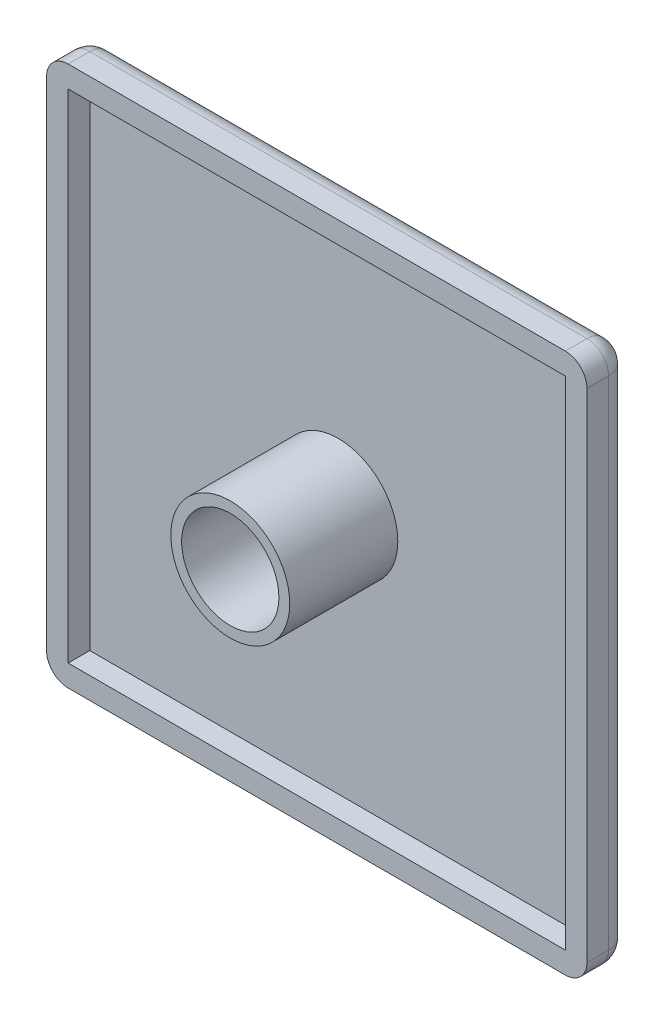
SolidWorks part; units mm, degrees
ref_plane "前视基准面" through (0, 0, 0) normal (0, 0, 1) x (1, 0, 0)
ref_plane "上视基准面" through (0, 0, 0) normal (0, 1, 0) x (1, 0, 0)
ref_plane "右视基准面" through (0, 0, 0) normal (1, 0, 0) x (0, 0, -1)
sketch "草图1" plane through (0, 0, 0) normal (0, 0, 1) x (1, 0, 0)
  line L1 (-25, 25) -> (25, 25)
  line L2 (-25, 25) -> (-25, -25)
  line L3 (-25, -25) -> (25, -25)
  line L4 (25, 25) -> (25, -25)
  dimension "D1" = 50
  dimension "D2" = 50
  dimension "D3" = 25
extrude "凸台-拉伸1" add sketch "草图1" along normal mid plane 4
fillet "圆角1" radius 2 8 edges at (-25, 25, 0) (-25, -25, 0) (-25, 0, -2) (0, -25, -2) (25, -25, 0) (25, 25, 0) (25, 0, -2) (0, 25, -2)
shell "抽壳1" thickness 2
sketch "草图2" plane through (0, 0, 0) normal (0, 0, 1) x (1, 0, 0)
  circle A0 centre (0, 0) radius 5.5
  circle A1 centre (0, 0) radius 4.5
extrude "凸台-拉伸2" add sketch "草图2" along normal blind 10
